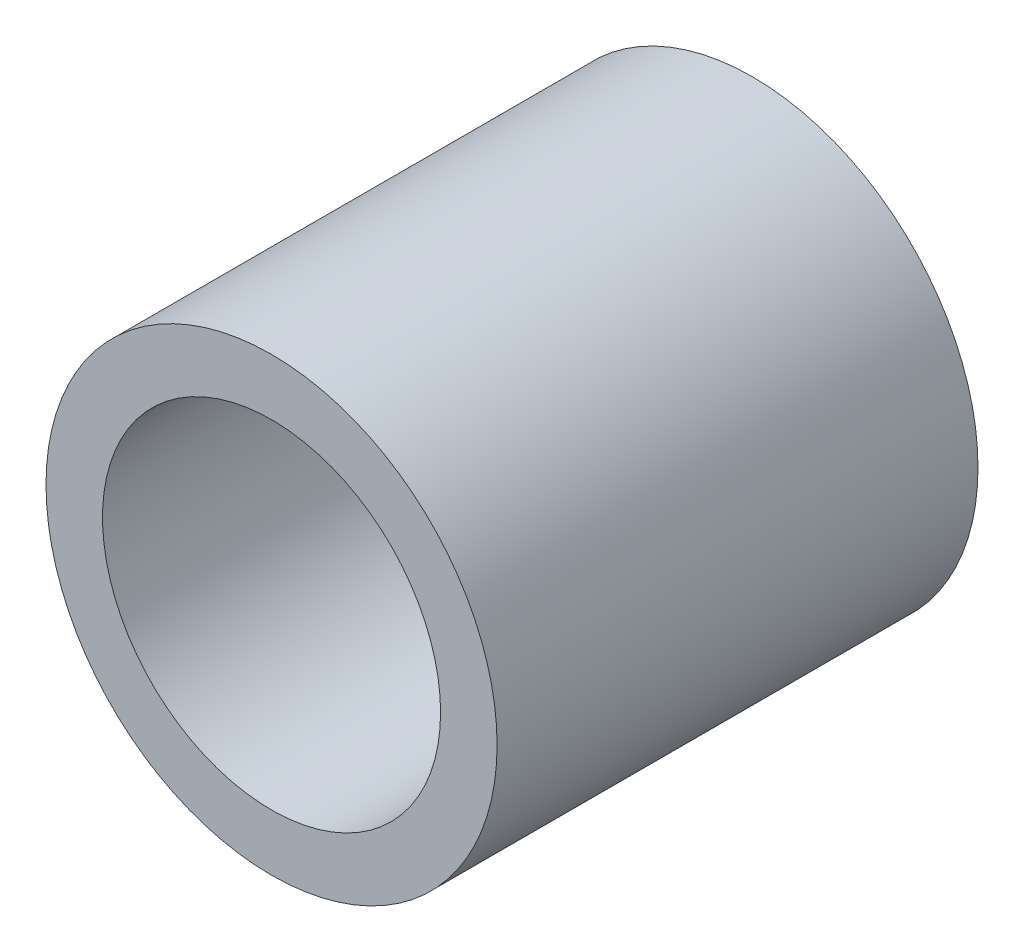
SolidWorks part; units mm, degrees
ref_plane "Front" through (0, 0, 0) normal (0, 0, 1) x (1, 0, 0)
ref_plane "Top" through (0, 0, 0) normal (0, 1, 0) x (1, 0, 0)
ref_plane "Right" through (0, 0, 0) normal (1, 0, 0) x (0, 0, -1)
sketch "Master Sketch" plane through (0, 0, 0) normal (0, 0, 1) x (1, 0, 0)
  circle A0 centre (0, 0) radius 2.9718
  circle A1 centre (0, 0) radius 4.464
  circle A2 centre (0, 0) radius 5.9563
sketch "Sketch2" plane through (0, 0, 0) normal (0, 0, 1) x (1, 0, 0)
  circle A0 centre (0, 0) radius 4.464 construction
  circle A1 centre (0, 0) radius 5.9563 construction
  circle A2 centre (0, 0) radius 4.464
  circle A3 centre (0, 0) radius 5.9563
extrude "Base-Extrude" add sketch "Sketch2" along normal mid plane 12.7
equation "\"Bushing Diameter@Master Sketch\" = \"Pin Diameter@Master Sketch\" +  (  ( \"Roller Diameter@Master Sketch\" - \"Pin Diameter@Master Sketch\" )  / 2 ) "
